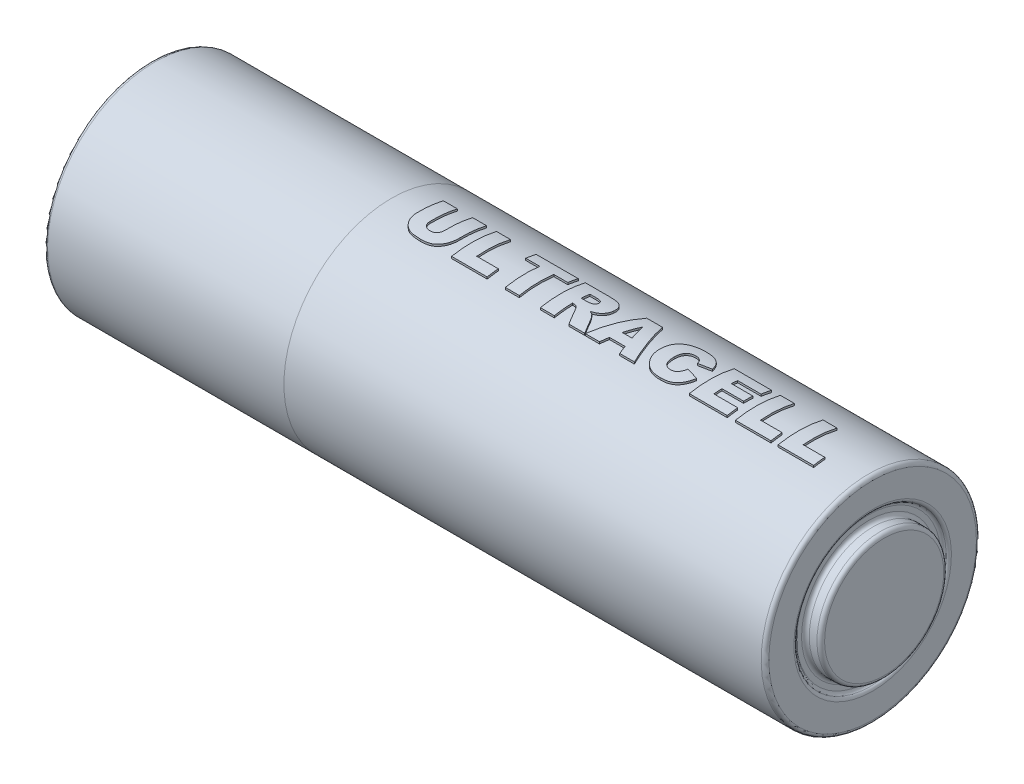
SolidWorks part; units mm, degrees
ref_plane "Plane1" through (0, 0, 0) normal (0, 0, 1) x (1, 0, 0)
ref_plane "Plane2" through (0, 0, 0) normal (0, 1, 0) x (1, 0, 0)
ref_plane "Plane3" through (0, 0, 0) normal (1, 0, 0) x (0, 0, -1)
sketch "Sketch1" plane through (0, 0, 0) normal (0, 0, 1) x (1, 0, 0)
  line L0 (0, 7.112) -> (47.6758, 7.112)
  line L1 (0, 7.112) -> (0, 0)
  line L2 (47.6758, 0) -> (0, 0)
  line L3 (47.6758, 0) -> (47.6758, 7.112)
  line L4 (0, 0) -> (47.6758, 0) construction
  dimension "BodyLength" = 47.6758
  dimension "BodyRadius" = 7.112
revolve "Base-Revolve" add sketch "Sketch1" angle 360 about L4
sketch "Sketch2" plane through (0, 0, 0) normal (-1, 0, 0) x (0, 0, 1)
  circle A0 centre (0, 0) radius 5.2578
  dimension "PositiveDepressionDiameter" = 10.5156
extrude "Cut-Extrude1" cut sketch "Sketch2" against normal blind 0.254
sketch "Sketch3" plane through (0.254, 0, 0) normal (-1, 0, 0) x (0, 0, 1)
  circle A0 centre (0, 0) radius 2.667
  dimension "PositiveExtentionDiameter" = 5.334
extrude "Boss-Extrude1" add sketch "Sketch3" along normal blind 1.524
sketch "Sketch4" plane through (47.6758, 0, 0) normal (1, 0, 0) x (0, 0, -1)
  circle A0 centre (0, 0) radius 4.953
  dimension "NegativeDepressionDiameter" = 9.906
extrude "Cut-Extrude2" cut sketch "Sketch4" against normal blind 0.254
sketch "Sketch5" plane through (47.4218, 0, 0) normal (1, 0, 0) x (0, 0, -1)
  circle A0 centre (0, 0) radius 4.191
  dimension "NegativeExtentionDiameter" = 8.382
extrude "Boss-Extrude2" add sketch "Sketch5" along normal blind 1.016
fillet "Fillet2" radius 0.254
fillet "Fillet3" radius 0.254
fillet "Fillet4" radius 0.254
fillet "Fillet5" radius 0.254
ref_plane "Plane5" through (0, 0, 40.2647) normal (0, 0, 1) x (1, 0, 0)
sketch "Sketch7" plane through (0, 0, 40.2647) normal (0, 0, 1) x (1, 0, 0)
  line L0 (15.875, 13.708) -> (15.875, -13.7786)
  line L1 (0, -50) -> (0, 50) construction
  dimension "D1" = 15.875
sketch "Sketch8" plane through (0, 0, 0) normal (0, 1, 0) x (1, 0, 0)
  text T0 "ULTRACELL" font "Arial Black" height in points 12
extrude "Boss-Extrude3" add sketch "Sketch8" along normal offset from surface (7.2058 mm away) 0.127
pattern_circular "CirPattern1" count 2 every 180
